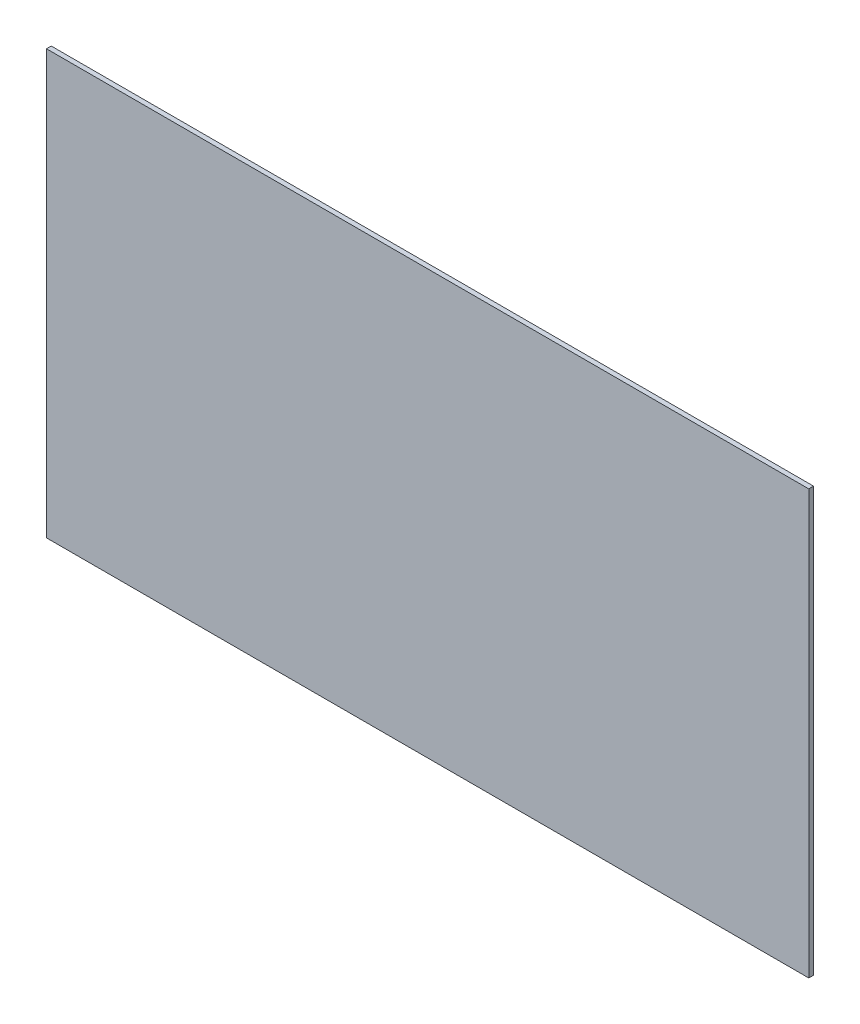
SolidWorks part; units mm, degrees
ref_plane "Plan de face" through (0, 0, 0) normal (0, 0, 1) x (1, 0, 0)
ref_plane "Plan de dessus" through (0, 0, 0) normal (0, 1, 0) x (1, 0, 0)
ref_plane "Plan de droite" through (0, 0, 0) normal (1, 0, 0) x (0, 0, -1)
sketch "Esquisse1" plane through (0, 0, 0) normal (0, 0, 1) x (1, 0, 0)
  line L1 (-34.7081, 22.1808) -> (35.5924, 22.1808)
  line L2 (-34.7081, 22.1808) -> (-34.7081, -23.3598)
  line L3 (-34.7081, -23.3598) -> (35.5924, -23.3598)
  line L4 (35.5924, 22.1808) -> (35.5924, -23.3598)
extrude "Extrusion1" add sketch "Esquisse1" against normal blind 35
other "Empreinte1"
other "boitier<1>@assemblage noyau boitier1"
sketch "Esquisse2" plane through (0, 0, 0) normal (0, 0, 1) x (1, 0, 0)
  line L2 (0.6257, 14.9988) -> (-0.6257, 14.9988)
  line L3 (-0.6257, -14.9988) -> (0.6257, -14.9988)
  line L4 (0.6257, 14.9988) -> (-0.6257, 14.9988)
  line L5 (-0.6257, -14.9988) -> (0.6257, -14.9988)
  arc A6 (-3.9511, 15.8389) -> (-0.6257, 14.9988) centre (-0.6257, 22) ccw
  arc A7 (-3.9511, 15.8389) -> (-3.9511, -15.8389) centre (-12.5, 0) ccw
  arc A8 (-0.6257, -14.9988) -> (-3.9511, -15.8389) centre (-0.6257, -22) ccw
  arc A9 (3.9511, -15.8389) -> (0.6257, -14.9988) centre (0.6257, -22) ccw
  arc A10 (3.9511, -15.8389) -> (3.9511, 15.8389) centre (12.5, 0) ccw
  arc A11 (0.6257, 14.9988) -> (3.9511, 15.8389) centre (0.6257, 22) ccw
  arc A12 (-3.9511, 15.8389) -> (-0.6257, 14.9988) centre (-0.6257, 22) ccw
  arc A13 (-3.9511, 15.8389) -> (-3.9511, -15.8389) centre (-12.5, 0) ccw
  arc A14 (-0.6257, -14.9988) -> (-3.9511, -15.8389) centre (-0.6257, -22) ccw
  arc A15 (3.9511, -15.8389) -> (0.6257, -14.9988) centre (0.6257, -22) ccw
  arc A16 (3.9511, -15.8389) -> (3.9511, 15.8389) centre (12.5, 0) ccw
  arc A17 (0.6257, 14.9988) -> (3.9511, 15.8389) centre (0.6257, 22) ccw
  dimension "D1" = 0
extrude "Extrusion2" add sketch "Esquisse2" along normal blind 2
sketch "Esquisse3" plane through (0, 0, 2) normal (0, 0, 1) x (1, 0, 0)
  line L1 (-101.8674, 42.9901) -> (218.4429, 42.9901)
  line L2 (-101.8674, 42.9901) -> (-101.8674, -134.9991)
  line L3 (-101.8674, -134.9991) -> (218.4429, -134.9991)
  line L4 (218.4429, 42.9901) -> (218.4429, -134.9991)
extrude "Extrusion3" add sketch "Esquisse3" along normal blind 2
fillet "Congé1" radius 2 8 edges at (-2.3406, 15.2121, 2) (0, 14.9988, 2) (2.3406, 15.2121, 2) (30.4988, 0, 2) (2.3406, -15.2121, 2) (0, -14.9988, 2) (-2.3406, -15.2121, 2) (-30.4988, 0, 2)
ref_plane "Plan4" through (0, 0, -9) normal (0, 0, -1) x (-1, 0, 0)
sketch "Esquisse4" plane through (0, 0, -9) normal (0, 0, -1) x (-1, 0, 0)
  line L1 (-4.732, 20.8054) -> (3.6561, 20.8054)
  line L2 (-4.732, 20.8054) -> (-4.732, 9.367)
  line L3 (-4.732, 9.367) -> (3.6561, 9.367)
  line L4 (3.6561, 20.8054) -> (3.6561, 9.367)
  line L5 (3.6561, -25.2024) -> (-4.732, -25.2024)
  line L6 (3.6561, -25.2024) -> (3.6561, -10.2054)
  line L7 (3.6561, -10.2054) -> (-4.732, -10.2054)
  line L8 (-4.732, -25.2024) -> (-4.732, -10.2054)
extrude "Enlèv. mat.-Extru.1" cut sketch "Esquisse4" along normal through all
